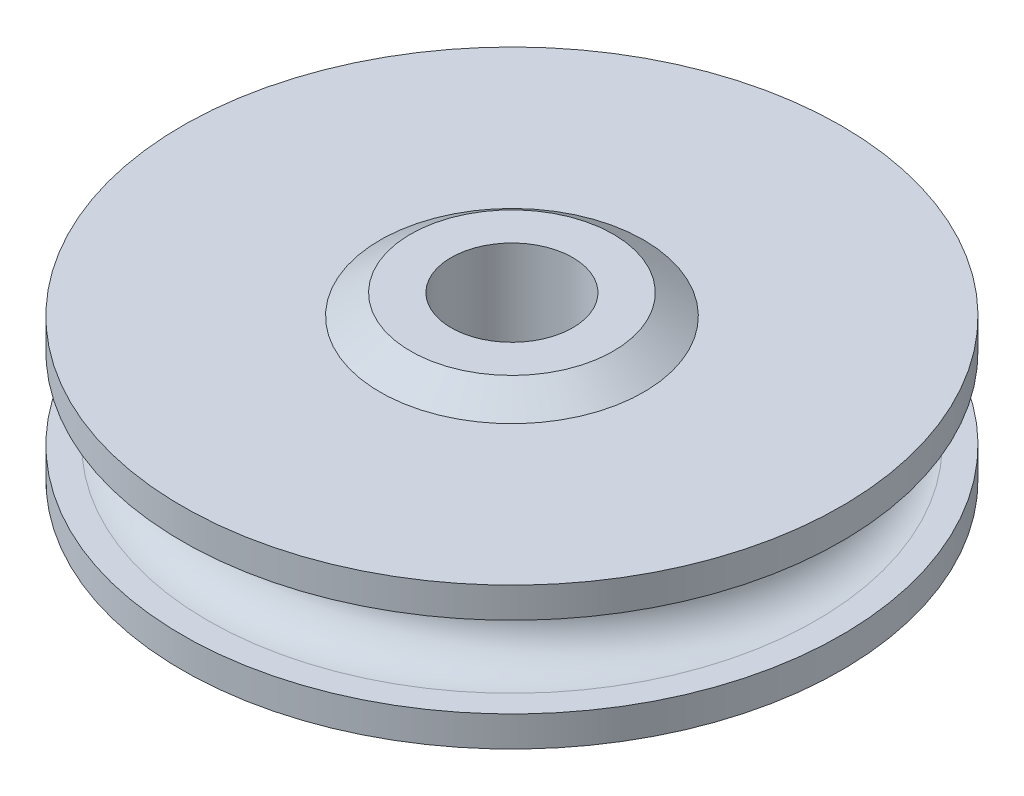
SolidWorks part; units mm, degrees
ref_plane "Plan de face" through (0, 0, 0) normal (0, 0, 1) x (1, 0, 0)
ref_plane "Plan de dessus" through (0, 0, 0) normal (0, 1, 0) x (1, 0, 0)
ref_plane "Plan de droite" through (0, 0, 0) normal (1, 0, 0) x (0, 0, -1)
sketch "Esquisse1" plane through (0, 0, 0) normal (0, 0, 1) x (1, 0, 0)
  line L0 (13, -7) -> (32.5, -7)
  line L1 (32.5, -7) -> (32.5, -4)
  line L2 (32.5, -4) -> (30, -4)
  line L3 (30, 4) -> (32.5, 4)
  line L4 (32.5, 4) -> (32.5, 7)
  line L5 (32.5, 7) -> (13, 7)
  line L6 (13, 7) -> (10, 9)
  line L7 (10, 9) -> (6, 9)
  line L8 (6, 9) -> (6, -9)
  line L9 (6, -9) -> (10, -9)
  line L10 (10, -9) -> (13, -7)
  line L11 (0, 9) -> (0, -9) construction
  arc A0 (30, -4) -> (30, 4) centre (30, 0) cw
revolve "Révolution1" add sketch "Esquisse1" angle 360 about L11
